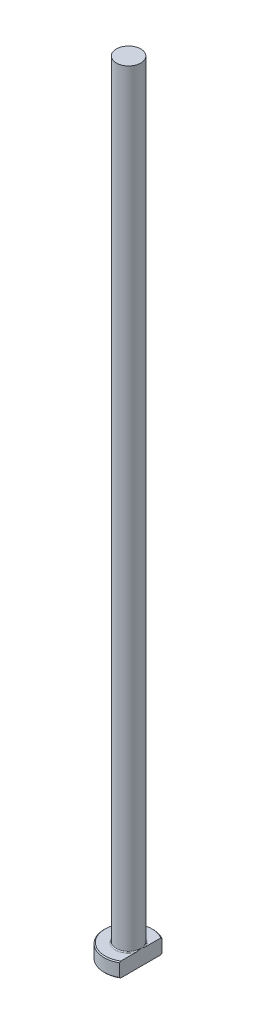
SolidWorks part; units mm, degrees
ref_plane "Front Plane" through (0, 0, 0) normal (0, 0, 1) x (1, 0, 0)
ref_plane "Top Plane" through (0, 0, 0) normal (0, 1, 0) x (1, 0, 0)
ref_plane "Right Plane" through (0, 0, 0) normal (1, 0, 0) x (0, 0, -1)
sketch "Sketch1" plane through (0, 0, 0) normal (0, 0, 1) x (1, 0, 0)
  line L0 (0, 259.9588) -> (0, -15.1925) construction
  line L1 (0, 0) -> (-5, 0)
  line L2 (-5, 0) -> (-5, 3)
  line L3 (-5, 3) -> (-2.5, 3)
  line L4 (-2.5, 3) -> (-2.5, 160)
  line L5 (-2.5, 160) -> (0, 160)
  line L6 (0, 160) -> (0, 0)
  dimension "L" = 160
  dimension "H" = 10
  dimension "T" = 3
  dimension "D" = 5
revolve "Revolve1" add sketch "Sketch1" angle 360 about L0
chamfer "Chamfer1" distance 0.2 angle 45 2 edges at (0, 3, 5) (0, 0, 5)
fillet "Fillet1" radius 0.2 1 edges at (0, 3, 2.5)
sketch "Sketch2" plane through (0, 0, 0) normal (0, 1, 0) x (1, 0, 0)
  line L0 (2.5, 4.3301) -> (2.5, -4.3301)
  circle A0 centre (0, 0) radius 5 construction
  arc A1 (2.5, -4.3301) -> (2.5, 4.3301) centre (0, 0) ccw
  circle A2 centre (0, 0) radius 2.5 construction
extrude "KEY" cut sketch "Sketch2" along normal through all
